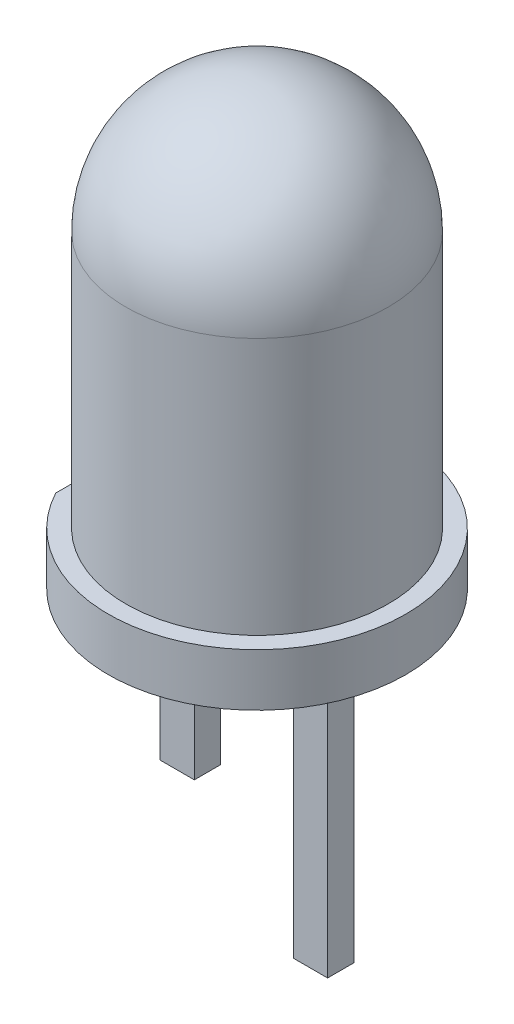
SolidWorks part; units mm, degrees
ref_plane "Plan de face" through (0, 0, 0) normal (0, 0, 1) x (1, 0, 0)
ref_plane "Plan de dessus" through (0, 0, 0) normal (0, 1, 0) x (1, 0, 0)
ref_plane "Plan de droite" through (0, 0, 0) normal (1, 0, 0) x (0, 0, -1)
sketch "Esquisse1" plane through (0, 0, 0) normal (0, 0, 1) x (1, 0, 0)
  line L0 (-2.5, 5.9) -> (-2.5, 1)
  line L1 (-2.5, 1) -> (-2.835, 1)
  line L2 (-2.835, 1) -> (-2.835, 0)
  line L3 (-2.835, 0) -> (0, 0)
  line L4 (0, 0) -> (0, 8.4)
  arc A0 (-2.5, 5.9) -> (0, 8.4) centre (0, 5.9) cw
  dimension "D5" = 8.4
  dimension "D6" = 2.5
  dimension "D1" = 2.835
  dimension "D2" = 1
  dimension "D3" = 0.335
revolve "Révolution1" add sketch "Esquisse1" angle 360 about L4
sketch "Esquisse2" plane through (0, 0, 0) normal (0, 0, 1) x (1, 0, 0)
  line L5 (-2.5, 1) -> (-3.7991, 1)
  line L6 (-2.5, 1) -> (-2.5, 0)
  line L7 (-2.5, 0) -> (-3.7991, 0)
  line L8 (-3.7991, 1) -> (-3.7991, 0)
extrude "Enlèv. mat.-Extru.1" cut sketch "Esquisse2" against normal mid plane 10
sketch "Esquisse3" plane through (0, 0, 0) normal (0, -1, 0) x (1, 0, 0)
  line L0 (-1.27, 0) -> (2.8977, 0) construction
  line L1 (0.945, 0.25) -> (1.595, 0.25)
  line L2 (0.945, 0.25) -> (0.945, -0.25)
  line L3 (0.945, -0.25) -> (1.595, -0.25)
  line L4 (1.595, 0.25) -> (1.595, -0.25)
  line L5 (1.27, 0) -> (1.27, -0.9015) construction
  line L6 (0, 0) -> (0, 1.697) construction
  line L7 (-1.595, 0.25) -> (-1.595, -0.25)
  line L8 (-0.945, -0.25) -> (-1.595, -0.25)
  line L9 (-0.945, 0.25) -> (-0.945, -0.25)
  line L10 (-0.945, 0.25) -> (-1.595, 0.25)
  circle A1 centre (0, 0) radius 1.27 construction
  dimension "D3" = 2.54
  dimension "D1" = 0.25
  dimension "D4" = 0.5
  dimension "D5" = 0.325
  dimension "D6" = 0.65
extrude "Extrusion1" add sketch "Esquisse3" along normal blind 5.5
ref_plane "Plan1" through (0, -1.6, 0) normal (0, -1, 0) x (1, 0, 0)
sketch "Esquisse5" plane through (0, 0, 0) normal (0, 0, 1) x (1, 0, 0)
  line L0 (0.945, 0) -> (0.945, 0.23)
  line L1 (0.945, 0.23) -> (0.2311, 0.3778)
  line L2 (0.2311, 0.3778) -> (-1.293, 3.5876)
  line L3 (-1.293, 3.5876) -> (-0.1037, 2.9816)
  line L4 (1.595, 0) -> (1.595, 3.5)
  line L5 (1.595, 3.5) -> (0.8063, 3.5)
  line L6 (0.8063, 3.5) -> (0.5215, 3.1248)
  line L8 (1.595, 0) -> (0.945, 0)
  line L9 (-1.595, 0) -> (-1.595, 3.2933)
  line L10 (-0.945, -5.5) -> (-0.945, 0) construction
  line L11 (-1.595, 3.2933) -> (-0.324, 0.6165)
  line L12 (-1.595, 0) -> (-0.945, 0)
  line L13 (-0.945, 0) -> (-0.945, 0.2717)
  line L14 (-0.945, 0.2717) -> (-0.324, 0.6165)
  line L15 (-2.5, 0) -> (2.835, 0) construction
  arc A0 (-0.1037, 2.9816) -> (0.5215, 3.1248) centre (0.1233, 3.4271) ccw
  dimension "D8" = 0.5
  dimension "D1" = 3.5
  dimension "D2" = 0.23
  dimension "D3" = 11.7
  dimension "D4" = 25.4
  dimension "D6" = 63
  dimension "D7" = 37.2
extrude "Extrusion3" add sketch "Esquisse5" along normal mid plane 0.5 separate body
sketch "Esquisse6" plane through (0, 0, 0.25) normal (0, 0, 1) x (1, 0, 0)
  line L1 (-0.945, -5.5) -> (-2.9524, -5.5)
  line L2 (-0.945, -5.5) -> (-0.945, -3.5)
  line L3 (-0.945, -3.5) -> (-2.9524, -3.5)
  line L4 (-2.9524, -5.5) -> (-2.9524, -3.5)
  dimension "D1" = 2
extrude "Enlèv. mat.-Extru.2" cut sketch "Esquisse6" against normal through all
